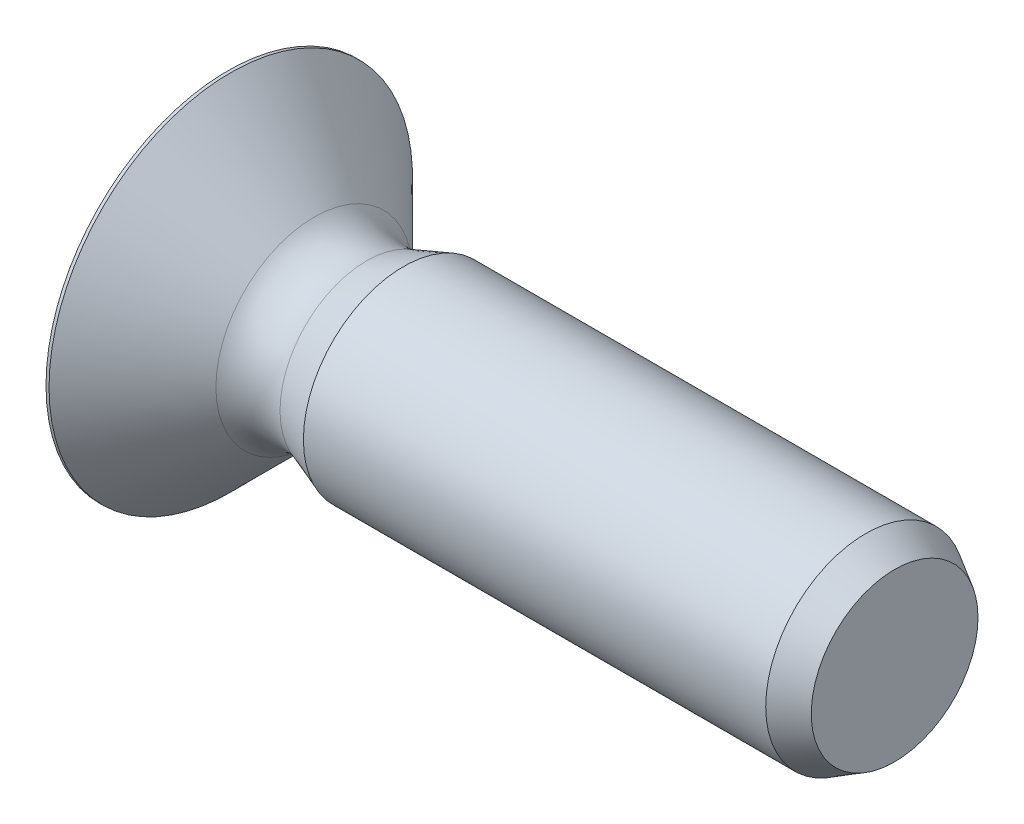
SolidWorks part; units mm, degrees
ref_plane "Front" through (0, 0, 0) normal (0, 0, 1) x (1, 0, 0)
ref_plane "Top" through (0, 0, 0) normal (0, 1, 0) x (1, 0, 0)
ref_plane "Right" through (0, 0, 0) normal (1, 0, 0) x (0, 0, -1)
sketch "Sketch1" plane through (0, 0, 0) normal (0, 0, 1) x (1, 0, 0)
  line L0 (-38.1054, 0) -> (11.3165, 0) construction
  line L1 (21.309, 0) -> (21.309, 3)
  line L2 (21.309, 3) -> (6.5779, 3)
  line L3 (6.5779, 3) -> (4.5779, 2.2721)
  line L4 (4.5779, 2.2721) -> (1.4, 5.45)
  line L5 (21.309, 0) -> (0, 0)
  line L6 (1.4, 5.45) -> (1.309, 5.45)
  line L7 (1.309, 5.45) -> (1.309, 0) construction
  arc A0 (1.309, 5.45) -> (0, 0) centre (12, 0) ccw
  dimension "D2" = 20
  dimension "rf" = 12
  dimension "D1" = 45
  dimension "d" = 6
  dimension "l" = 20
  dimension "dk" = 10.9
  dimension "a" = 2
  dimension "f" = 1.4
revolve "Base" add sketch "Sketch1" angle 360 about L0
sketch "Sketch2" plane through (0, 0, 0) normal (0, 1, 0) x (1, 0, 0)
  line L0 (22.6372, 0) -> (0, 0) construction
  line L1 (21.309, -3) -> (21.309, 3) construction
  line L2 (20.443, -3) -> (21.309, -2.5)
  line L6 (21.309, -2.5) -> (21.309, -3)
  line L7 (21.309, -3) -> (20.443, -3)
  dimension "D1" = 30
  dimension "D2" = 5
  dimension "D3" = 6
revolve "BaseEnd" cut sketch "Sketch2" angle 360 about L0
sketch "Sketch3" plane through (0, 0, 0) normal (-1, 0, 0) x (0, 0, 1)
  line L0 (0, 0) -> (-3.9695, 0) construction
  line L1 (0, 0) -> (0, 3.5828) construction
  line L2 (0.73, 3.65) -> (-0.73, 3.65)
  line L3 (-0.73, 3.65) -> (-0.73, 0.73)
  line L4 (-0.73, 0.73) -> (-3.65, 0.73)
  line L5 (-3.65, 0.73) -> (-3.65, -0.73)
  line L6 (-0.73, -0.73) -> (-3.65, -0.73)
  line L7 (-0.73, -3.65) -> (-0.73, -0.73)
  line L8 (0.73, -3.65) -> (-0.73, -3.65)
  line L9 (0.73, -3.65) -> (0.73, -0.73)
  line L10 (0.73, -0.73) -> (3.65, -0.73)
  line L11 (3.65, 0.73) -> (3.65, -0.73)
  line L12 (0.73, 0.73) -> (3.65, 0.73)
  line L13 (0.73, 3.65) -> (0.73, 0.73)
  point P4 (3.65, 0)
  point P10 (-3.65, 0)
  point P14 (0, -3.65)
  point P19 (0, 3.65)
  dimension "m" = 7.3
  dimension "D2" = 1.46
extrude "CrossRecess" cut sketch "Sketch3" against normal blind 2.725
draft "Draft1" type of draft neutral plane draft angle 45 neutral plane "Right" faces to draft 4 parameters "D1"=45
fillet "Fillet1" radius 1.5 1 edges at (4.5779, 0, 2.2721)
sketch "Sketch6" plane through (0, 0, 0) normal (0, 1, 0) x (1, 0, 0)
  line L0 (0, 0) -> (23.9872, 0) construction
  line L1 (20.4359, 3.0141) -> (20.45, 3.0141)
  line L2 (20.45, 3.0141) -> (20.45, 3)
  line L3 (20.45, 3) -> (20.443, 2.9878)
  line L4 (20.443, 2.9878) -> (20.4359, 3)
  line L5 (20.4359, 3) -> (20.4359, 3.0141)
  line L6 (20.443, 3) -> (20.443, -3) construction
  dimension "D1" = 6
  dimension "D2" = 2.9878
revolve "Cut-Revolve10" [suppressed] cut sketch "Sketch6" angle 360 about L0
pattern_linear "LPattern10" [suppressed] count 912 spacing 0.0183 along (1, 0, 0)
sketch "Sketch5" plane through (0, 0, 0) normal (0, 1, 0) x (1, 0, 0)
  line L0 (15.3245, 0) -> (-0.2214, 0) construction
  line L2 (3.8622, 2.9878) -> (10.1963, 2.9878)
  line L3 (10.1963, 2.9878) -> (11.4864, 3)
  line L5 (11.4864, 3) -> (3.85, 3)
  line L6 (3.85, 3) -> (3.8622, 2.9878)
  line L10 (21.309, -2.5) -> (21.309, 2.5) construction
  line L11 (1.4, -5.45) -> (1.4, 5.45) construction
  dimension "D1" = 2.9878
  dimension "D3" = 6
  dimension "b" = 9.8226
  dimension "D4" = 45
  dimension "x" = 1.2901
  dimension "D5" = 2.4622
revolve "Cut-Revolve2" [suppressed] cut sketch "Sketch5" angle 360 about L0
equation "\"D2@ThreadCosmetic1\" = \"d@Sketch1\" - 1"
equation "\"D2@Sketch2\" = \"D2@ThreadCosmetic1\""
equation "\"D3@Sketch2\" = \"d@Sketch1\""
equation "\"D2@Sketch3\" = \"m@Sketch3\" / 5"
equation "\"D1@Sketch5\" = \"d@Sketch1\" / 2 - \"a@Sketch1\" * tan ( 3.14 / 9 ) "
equation "\"D1@CrossRecess\" = \"dk@Sketch1\" /4"
equation "\"D1@Sketch6\" = \"d@Sketch1\""
equation "\"D2@Sketch6\" =  \"d@Sketch1\" / 2 - \"a@Sketch1\" * tan ( 3.14 / 9 ) "
equation "\"D3@LPattern10\" =  ( \"D1@Sketch6\" / 2 - \"D2@Sketch6\" )  * 1.5"
equation "\"D1@LPattern10\" =  ( \"l@Sketch1\" -  ( \"dk@Sketch1\" - \"d@Sketch1\" )  / 2 - (  \"D3@Sketch2\" - \"D2@Sketch2\" )  / 2 * 1.732 )  / \"D3@LPattern10\" - 1"
equation "\"D3@Sketch5\" = \"d@Sketch1\""
equation "\"D5@Sketch5\" =   \"dk@Sketch1\" / 2 - \"D1@Sketch5\""
